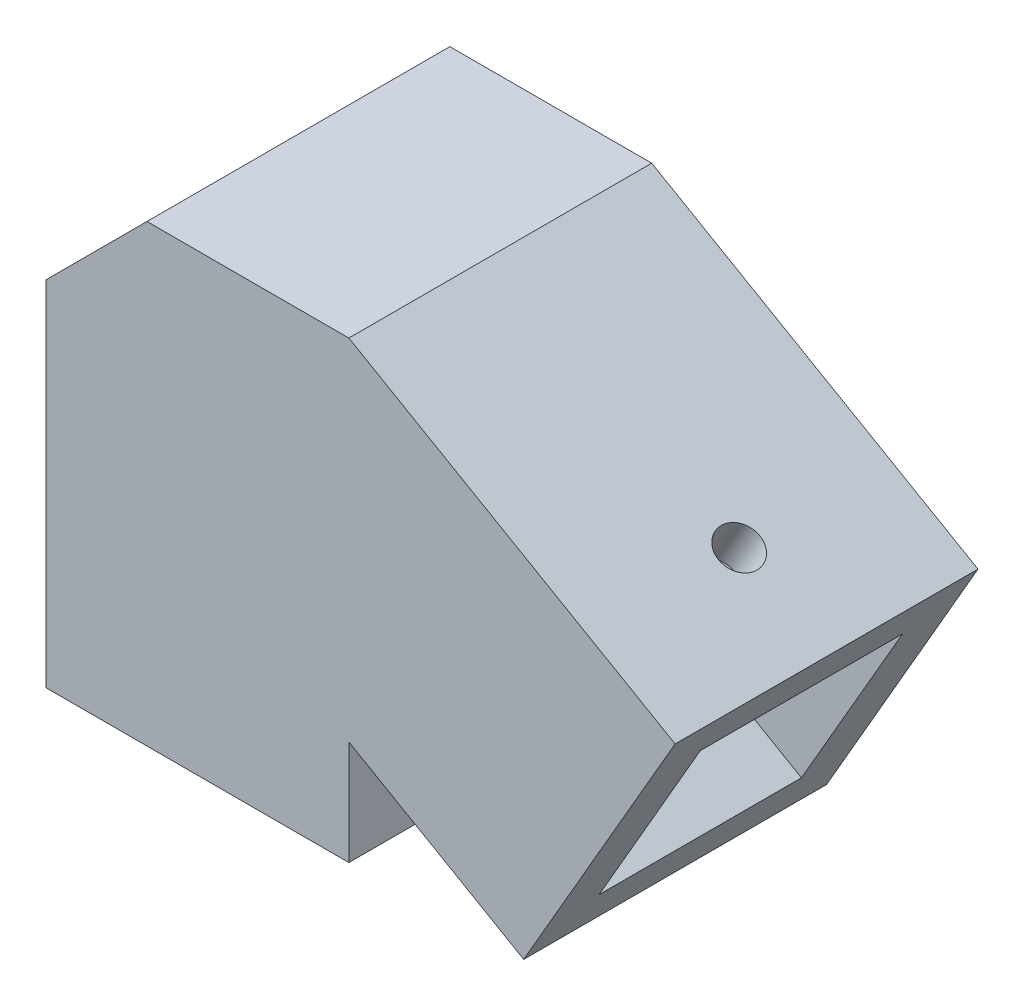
SolidWorks part; units mm, degrees
ref_plane "Alzado" through (0, 0, 0) normal (0, 0, 1) x (1, 0, 0)
ref_plane "Planta" through (0, 0, 0) normal (0, 1, 0) x (1, 0, 0)
ref_plane "Vista lateral" through (0, 0, 0) normal (1, 0, 0) x (0, 0, -1)
sketch "Croquis2" plane through (0, 0, 0) normal (0, 1, 0) x (1, 0, 0)
  line L1 (-15, -15) -> (15, -15)
  line L2 (-15, -15) -> (-15, 15)
  line L3 (-15, 15) -> (15, 15)
  line L4 (15, -15) -> (15, 15)
  line L5 (-15, -15) -> (15, 15) construction
  line L6 (-15, 15) -> (15, -15) construction
  point P0 (0, 0)
  dimension "D1" = 30
  dimension "D2" = 30
extrude "Saliente-Extruir1" add sketch "Croquis2" along normal blind 20 and the other way blind 25
sketch "Croquis3" plane through (0, 0, 15) normal (0, 0, 1) x (1, 0, 0)
  line L0 (15, 20) -> (47.3205, 1.3397)
  line L1 (15, -25) -> (15, 20) construction
  line L4 (15, -14.641) -> (15, 20)
  line L5 (15, -14.641) -> (32.3205, -24.641)
  line L6 (32.3205, -24.641) -> (47.3205, 1.3397)
  dimension "D1" = 60
  dimension "D2" = 90
  dimension "D3" = 20
  dimension "D4" = 30
extrude "Saliente-Extruir2" add sketch "Croquis3" against normal up to surface (30 mm away)
sketch "Croquis4" plane through (0, -25, 0) normal (0, -1, 0) x (1, 0, 0)
  line L1 (-10.025, -10.025) -> (10.025, -10.025)
  line L2 (-10.025, -10.025) -> (-10.025, 10.025)
  line L3 (-10.025, 10.025) -> (10.025, 10.025)
  line L4 (10.025, -10.025) -> (10.025, 10.025)
  line L5 (-10.025, -10.025) -> (10.025, 10.025) construction
  line L6 (-10.025, 10.025) -> (10.025, -10.025) construction
  point P0 (0, 0)
  dimension "D1" = 20.05
  dimension "D2" = 20.05
extrude "Cortar-Extruir1" cut sketch "Croquis4" against normal blind 20
sketch "Croquis5" plane through (34.9103, -20.1554, 0) normal (0.866, -0.5, 0) x (0, 0, -1)
  line L0 (15, 24.8205) -> (-15, 24.8205) construction
  line L6 (-10.025, -0.2045) -> (10.025, -0.2045)
  line L8 (-10.025, -0.2045) -> (-10.025, 19.8455)
  line L9 (-10.025, 19.8455) -> (10.025, 19.8455)
  line L10 (10.025, -0.2045) -> (10.025, 19.8455)
  line L11 (-10.025, -0.2045) -> (10.025, 19.8455) construction
  line L12 (-10.025, 19.8455) -> (10.025, -0.2045) construction
  point P0 (0, 9.8205)
  dimension "D1" = 20.05
  dimension "D2" = 20.05
  dimension "D3" = 15
extrude "Cortar-Extruir2" cut sketch "Croquis5" along a picked direction on the side against the normal blind 23
chamfer "Chaflán1" distance 10 angle 45 1 edges at (-15, 20, 0)
sketch "Croquis6" plane through (12.4103, 21.4952, 0) normal (0.5, 0.866, 0) x (0, 0, -1)
  line L0 (15, -40.3109) -> (-15, -40.3109) construction
  circle A0 centre (0, -30.3109) radius 2.05
  dimension "D1" = 4.1
  dimension "D2" = 10
extrude "Cortar-Extruir3" cut sketch "Croquis6" against normal up to surface (4.975 mm away) contours A0
sketch "Croquis7" plane through (-15, 0, 0) normal (-1, 0, 0) x (0, 0, 1)
  line L0 (-15, -25) -> (15, -25) construction
  circle A0 centre (0, -15) radius 2.05
  dimension "D1" = 4.1
  dimension "D2" = 10
extrude "Cortar-Extruir4" cut sketch "Croquis7" against normal up to surface (4.975 mm away)
